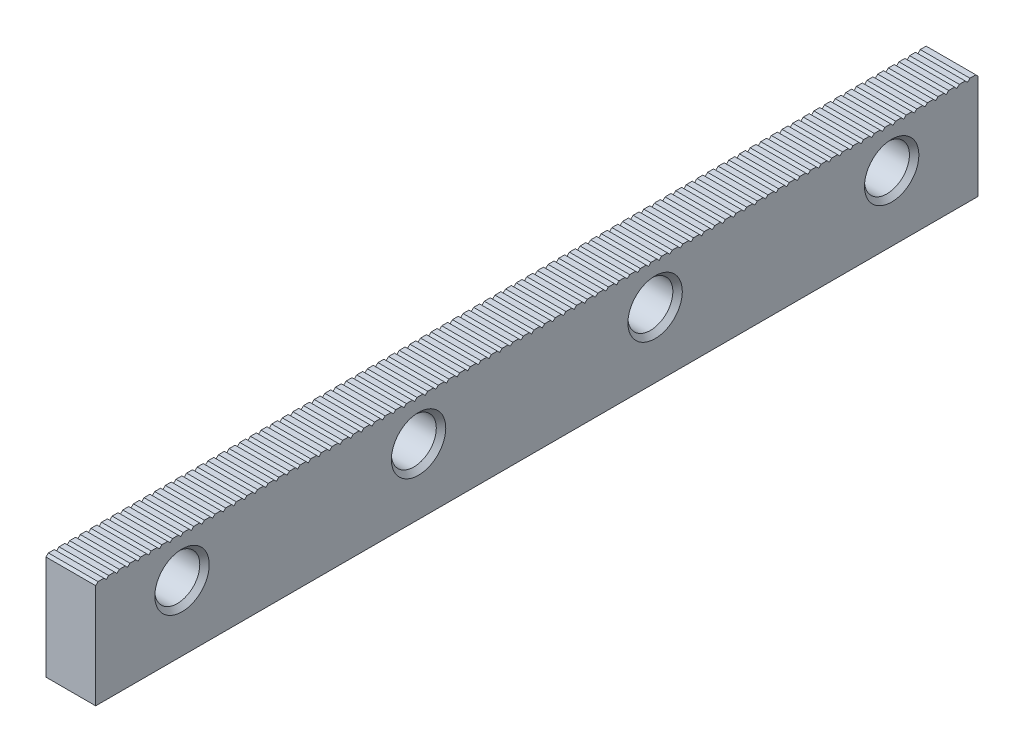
SolidWorks part; units mm, degrees
ref_plane "Front Plane" through (0, 0, 0) normal (0, 0, 1) x (1, 0, 0)
ref_plane "Top Plane" through (0, 0, 0) normal (0, 1, 0) x (1, 0, 0)
ref_plane "Right Plane" through (0, 0, 0) normal (1, 0, 0) x (0, 0, -1)
sketch "Sketch1" plane through (0, 0, 0) normal (1, 0, 0) x (0, 0, -1)
  line L1 (37.3, -4.5) -> (-37.3, -4.5)
  line L2 (37.3, -4.5) -> (37.3, 4.5)
  line L3 (37.3, 4.5) -> (-37.3, 4.5)
  line L4 (-37.3, -4.5) -> (-37.3, 4.5)
  line L5 (37.3, -4.5) -> (-37.3, 4.5) construction
  line L6 (37.3, 4.5) -> (-37.3, -4.5) construction
  point P0 (0, 0)
  dimension "D1" = 74.6
  dimension "D2" = 9
extrude "Boss-Extrude1" add sketch "Sketch1" along normal mid plane 4.2
sketch "Sketch2" plane through (0, 0, 0) normal (1, 0, 0) x (0, 0, -1)
  line L0 (-37.3, 4.3) -> (-37.5, 4.5)
  line L1 (-37.3, 4.5) -> (-37.3, -4.5) construction
  line L2 (-37.5, 4.5) -> (-37.1, 4.5)
  line L3 (37.3, 4.5) -> (-37.3, 4.5) construction
  line L4 (-37.1, 4.5) -> (-37.3, 4.3)
  line L5 (-37.3, -4.5) -> (37.3, -4.5) construction
  point P8 (-37.3, 4.3)
  dimension "D1" = 8.8
extrude "Cut-Extrude1" cut sketch "Sketch2" against normal mid plane 4.2
pattern_linear "LPattern1" count 105 spacing 0.899 along (0, -0.7071, -0.7071) of "Cut-Extrude1"
sketch "Sketch3" plane through (0, 0, 0) normal (1, 0, 0) x (0, 0, -1)
  line L0 (-37.3, -4.5) -> (37.3, -4.5) construction
  line L1 (-37.3, 4.3) -> (-37.3, -4.5) construction
  circle A0 centre (-30, 1.04) radius 1.9
  dimension "D3" = 3.8
  dimension "D1" = 5.54
  dimension "D2" = 7.3
extrude "Cut-Extrude2" cut sketch "Sketch3" against normal mid plane 4.2
chamfer "Chamfer1" distance 0.4 angle 45 2 edges at (-2.1, 1.04, 28.1) (2.1, 1.04, 28.1)
pattern_linear "LPattern2" count 4 spacing 20 along (0, 0, -1) of "Cut-Extrude2", "Chamfer1"
